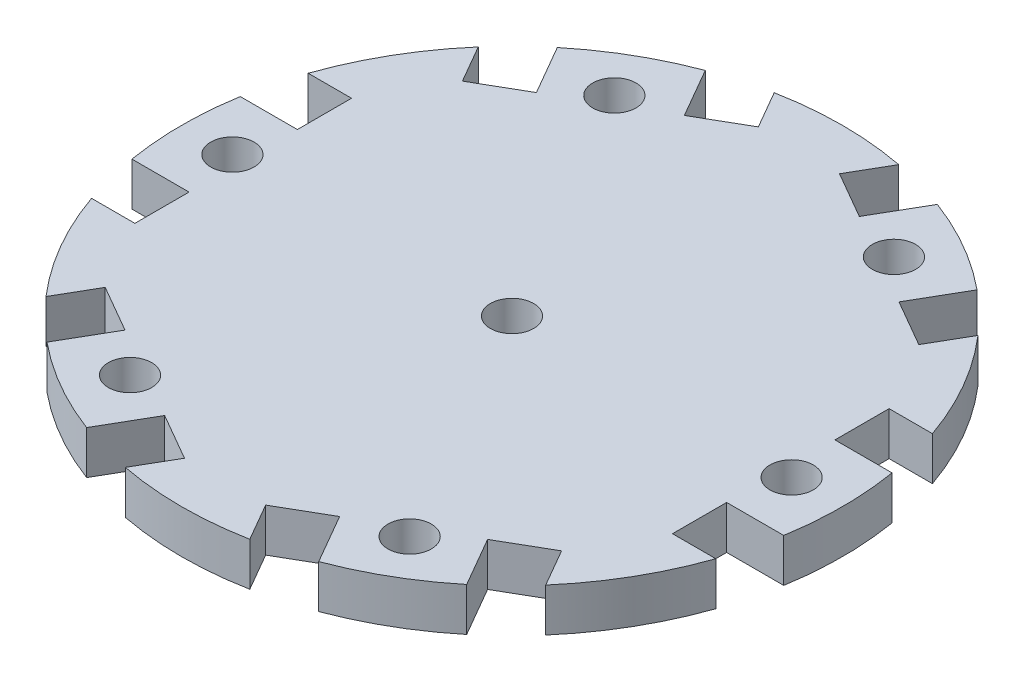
SolidWorks part; units mm, degrees
ref_plane "Alzado" through (0, 0, 0) normal (0, 0, 1) x (1, 0, 0)
ref_plane "Planta" through (0, 0, 0) normal (0, 1, 0) x (1, 0, 0)
ref_plane "Vista lateral" through (0, 0, 0) normal (1, 0, 0) x (0, 0, -1)
sketch "Croquis1" plane through (0, 0, 0) normal (0, 1, 0) x (1, 0, 0)
  circle A0 centre (0, 0) radius 30.5
extrude "Saliente-Extruir1" add sketch "Croquis1" along normal blind 4
sketch "Croquis2" plane through (0, 4, 0) normal (0, 1, 0) x (1, 0, 0)
  circle A0 centre (0, 0) radius 2
extrude "Cortar-Extruir1" cut sketch "Croquis2" against normal blind 4
sketch "Croquis5" plane through (0, 4, 0) normal (0, 1, 0) x (1, 0, 0)
  line L1 (28.8141, -5) -> (30.0874, -5)
  line L2 (28.8141, 5) -> (30.0874, 5)
  line L3 (-24.8141, 10) -> (-28.8141, 10)
  line L4 (24.8141, -5) -> (24.8141, -10)
  line L5 (-24.8141, -10) -> (-28.8141, -10)
  line L6 (24.8141, -5) -> (28.8141, -5)
  line L7 (24.8141, 5) -> (24.8141, 10)
  line L8 (-24.8141, 5) -> (-28.8141, 5)
  line L9 (-24.8141, 5) -> (-24.8141, 10)
  line L10 (-24.8141, -5) -> (-28.8141, -5)
  line L11 (-24.8141, -5) -> (-24.8141, -10)
  line L12 (24.8141, 5) -> (28.8141, 5)
  line L13 (24.8141, -10) -> (28.8141, -10)
  line L14 (24.8141, 10) -> (28.8141, 10)
  line L15 (-28.8141, 5) -> (-30.0874, 5)
  line L16 (-28.8141, -5) -> (-30.0874, -5)
  line L17 (18.7372, 22.4537) -> (19.3738, 23.5564)
  line L18 (-24.8141, 0) -> (-12.407, -21.4896)
  line L19 (-12.407, -21.4896) -> (12.407, -21.4896)
  line L20 (12.407, -21.4896) -> (24.8141, 0)
  line L21 (24.8141, 0) -> (12.407, 21.4896)
  line L22 (12.407, 21.4896) -> (-12.407, 21.4896)
  line L23 (-12.407, 21.4896) -> (-24.8141, 0)
  line L24 (-21.0673, -16.4896) -> (-23.0673, -19.9537)
  line L25 (-3.7468, -26.4896) -> (-5.7468, -29.9537)
  line L26 (-16.7372, -18.9896) -> (-18.7372, -22.4537)
  line L27 (-16.7372, -18.9896) -> (-21.0673, -16.4896)
  line L28 (-8.0769, -23.9896) -> (-10.0769, -27.4537)
  line L29 (-8.0769, -23.9896) -> (-3.7468, -26.4896)
  line L30 (-18.7372, -22.4537) -> (-19.3738, -23.5564)
  line L31 (-10.0769, -27.4537) -> (-10.7136, -28.5564)
  line L32 (10.0769, 27.4537) -> (10.7136, 28.5564)
  line L33 (16.7372, 18.9896) -> (21.0673, 16.4896)
  line L34 (16.7372, 18.9896) -> (18.7372, 22.4537)
  line L35 (8.0769, 23.9896) -> (3.7468, 26.4896)
  line L36 (8.0769, 23.9896) -> (10.0769, 27.4537)
  line L37 (21.0673, 16.4896) -> (23.0673, 19.9537)
  line L38 (3.7468, 26.4896) -> (5.7468, 29.9537)
  line L39 (-3.7468, 26.4896) -> (-5.7468, 29.9537)
  line L40 (-21.0673, 16.4896) -> (-23.0673, 19.9537)
  line L41 (-8.0769, 23.9896) -> (-10.0769, 27.4537)
  line L42 (-8.0769, 23.9896) -> (-3.7468, 26.4896)
  line L43 (-16.7372, 18.9896) -> (-18.7372, 22.4537)
  line L44 (-16.7372, 18.9896) -> (-21.0673, 16.4896)
  line L45 (-10.0769, 27.4537) -> (-10.7136, 28.5564)
  line L46 (-18.7372, 22.4537) -> (-19.3738, 23.5564)
  line L47 (10.0769, -27.4537) -> (10.7136, -28.5564)
  line L48 (18.7372, -22.4537) -> (19.3738, -23.5564)
  line L49 (8.0769, -23.9896) -> (3.7468, -26.4896)
  line L50 (8.0769, -23.9896) -> (10.0769, -27.4537)
  line L51 (16.7372, -18.9896) -> (21.0673, -16.4896)
  line L52 (16.7372, -18.9896) -> (18.7372, -22.4537)
  line L53 (3.7468, -26.4896) -> (5.7468, -29.9537)
  line L54 (21.0673, -16.4896) -> (23.0673, -19.9537)
  circle A0 centre (0, 0) radius 21.4896 construction
  circle A1 centre (0, 0) radius 30.5 construction
  arc A2 (-28.8141, 10) -> (-30.0874, 5) centre (0, 0) ccw
  arc A3 (-5.7468, 29.9537) -> (-10.7136, 28.5564) centre (0, 0) ccw
  arc A4 (-30.0874, -5) -> (-28.8141, -10) centre (0, 0) ccw
  arc A5 (30.0874, -5) -> (28.8141, -10) centre (0, 0) cw
  arc A6 (28.8141, 10) -> (30.0874, 5) centre (0, 0) cw
  arc A7 (-23.0673, -19.9537) -> (-19.3738, -23.5564) centre (0, 0) ccw
  arc A8 (-10.7136, -28.5564) -> (-5.7468, -29.9537) centre (0, 0) ccw
  arc A9 (-19.3738, 23.5564) -> (-23.0673, 19.9537) centre (0, 0) ccw
  arc A10 (19.3738, 23.5564) -> (23.0673, 19.9537) centre (0, 0) cw
  arc A11 (5.7468, 29.9537) -> (10.7136, 28.5564) centre (0, 0) cw
  arc A12 (10.7136, -28.5564) -> (5.7468, -29.9537) centre (0, 0) cw
  arc A13 (23.0673, -19.9537) -> (19.3738, -23.5564) centre (0, 0) cw
extrude "Cortar-Extruir3" cut sketch "Croquis5" against normal blind 4 contours L15 L8 L9 L3 M2 | L14 L7 L12 L2 M2 | L4 L13 L1 L6 M2 | L54 L51 L52 L48 M2 | L49 L53 L47 L50 M2 | L28 L31 L25 L29 M2 | L30 L26 L27 L24 M2 | L10 L16 L5 L11 M2 | L43 L46 L40 L44 M2 | L45 L41 L42 L39 M2 | L38 L35 L36 L32 M2 | L33 L37 L17 L34 M2
sketch "Croquis7" plane through (0, 4, 0) normal (0, 1, 0) x (1, 0, 0)
  line L2 (25.8141, 0) -> (12.907, 22.3556)
  line L3 (12.907, 22.3556) -> (-12.907, 22.3556)
  line L4 (-12.907, 22.3556) -> (-25.8141, 0)
  line L5 (-25.8141, 0) -> (-12.907, -22.3556)
  line L6 (-12.907, -22.3556) -> (12.907, -22.3556)
  line L7 (12.907, -22.3556) -> (25.8141, 0)
  circle A0 centre (25.8141, 0) radius 2
  circle A4 centre (-25.8141, 0) radius 2
  circle A5 centre (0, 0) radius 22.3556 construction
  circle A6 centre (12.907, 22.3556) radius 2
  circle A7 centre (-12.907, -22.3556) radius 2
  circle A8 centre (-12.907, 22.3556) radius 2
  circle A9 centre (12.907, -22.3556) radius 2
extrude "Cortar-Extruir4" cut sketch "Croquis7" against normal blind 10 contours A8 L4 L3 | A4 L4 L5 | A4 L5 L4 | A8 L3 L4 | L2 A6 L3 | L3 A6 L2 | L7 A0 L2 | L2 A0 L7 | A7 L5 L6 | A7 L6 L5 | L6 A9 L7 | L7 A9 L6
